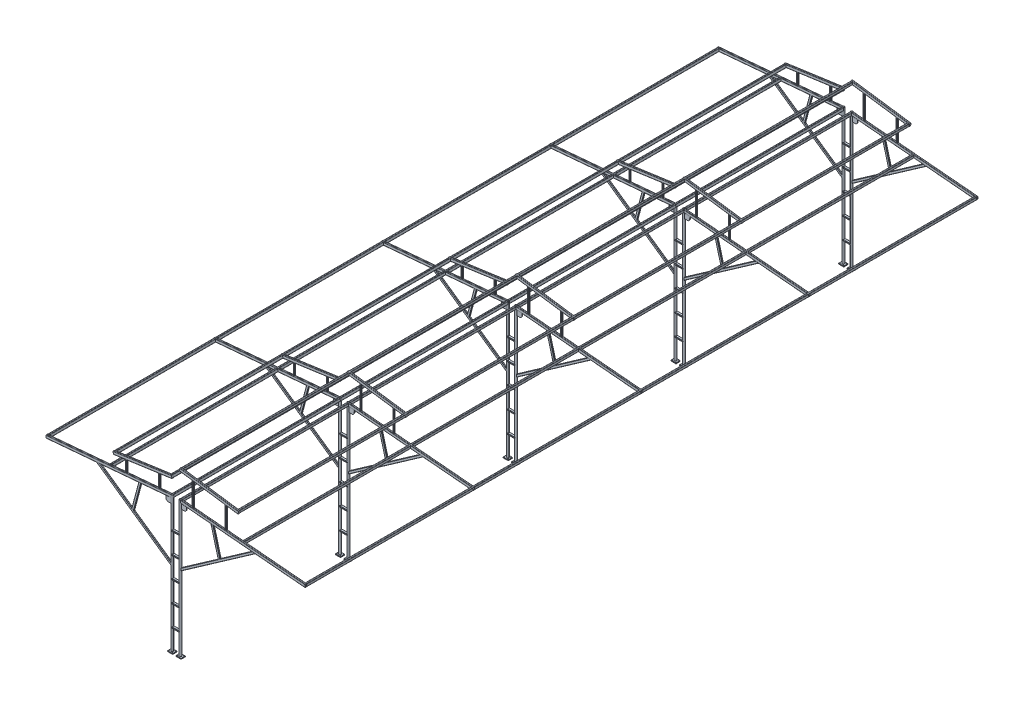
SolidWorks part; units mm, degrees
ref_plane "Default Plane" through (60, 0, 16050) normal (0, -1, 0) x (-1, 0, 0)
sketch3d "Bounding-Box_Cut-List-Item1"
  line L0 (0, 100, 0) -> (120, 100, 0) construction
  line L1 (120, 100, 0) -> (120, 0, 0) construction
  line L2 (120, 0, 0) -> (0, 0, 0) construction
  line L3 (0, 0, 0) -> (0, 100, 0) construction
  line L4 (0, 100, 20) -> (120, 100, 20) construction
  line L5 (120, 100, 20) -> (120, 0, 20) construction
  line L6 (120, 0, 20) -> (0, 0, 20) construction
  line L7 (0, 0, 20) -> (0, 100, 20) construction
  line L8 (0, 100, 0) -> (0, 100, 20) construction
  line L9 (120, 100, 0) -> (120, 100, 20) construction
  line L10 (120, 0, 0) -> (120, 0, 20) construction
  line L11 (0, 0, 0) -> (0, 0, 20) construction
ref_plane "Front Plane" through (0, 0, 0) normal (0, 0, 1) x (1, 0, 0)
ref_plane "Top Plane" through (0, 0, 0) normal (0, 1, 0) x (1, 0, 0)
ref_plane "Right Plane" through (0, 0, 0) normal (1, 0, 0) x (0, 0, -1)
other "Configuration Table"
ref_plane "Plane1" through (0, 0, 4000) normal (0, 0, 1) x (1, 0, 0)
ref_plane "Plane2" through (0, 0, 8000) normal (0, 0, 1) x (1, 0, 0)
ref_plane "Plane3" through (0, 0, 12000) normal (0, 0, 1) x (1, 0, 0)
ref_plane "Plane4" through (0, 0, 16000) normal (0, 0, 1) x (1, 0, 0)
sketch "Sketch1" plane through (0, 0, 0) normal (0, 0, 1) x (1, 0, 0)
  line L0 (-200, 0) -> (-200, 3200)
  line L1 (0, 0) -> (0, 3200)
  line L2 (-200, 3200) -> (-3188.5841, 2938.5328)
  line L3 (0, 3200) -> (2988.5841, 2938.5328)
  line L4 (-200, 1782.1468) -> (-2000, 3042.5204)
  line L5 (-950, 3134.3835) -> (-1136.6049, 2437.9646)
  line L6 (0, 1782.1468) -> (1800, 3042.5204)
  line L7 (750, 3134.3835) -> (936.6049, 2437.9646)
  line L8 (-100, 436.796) -> (-100, 4123.4848) construction
  line L9 (-500, 3173.7534) -> (-500, 3557.8377)
  line L10 (-1286.3753, 3104.9545) -> (-1286.3753, 3447.3199)
  line L11 (-1586.3753, 3405.1577) -> (-200, 3600)
  line L12 (0, 3850) -> (1386.3753, 3655.1577)
  line L13 (300, 3807.8377) -> (300, 3173.7534)
  line L14 (1086.3753, 3697.3199) -> (1086.3753, 3104.9545)
  dimension "D1" = 3200
  dimension "D2" = 3200
  dimension "D3" = 200
  dimension "D4" = 85
  dimension "D5" = 3000
  dimension "D6" = 85
  dimension "D7" = 40
  dimension "D8" = 70
  dimension "D9" = 750
  dimension "D10" = 1800
  dimension "D11" = 1800
  dimension "D12" = 750
  dimension "D13" = 70
  dimension "D14" = 1400
  dimension "D15" = 400
  dimension "D16" = 300
  dimension "D17" = 300
  dimension "D18" = 3
  dimension "D19" = 650
  dimension "D20" = 1400
  dimension "D21" = 300
  dimension "D22" = 3
  dimension "D23" = 300
sketch "Sketch3" plane through (0, 0, 4000) normal (0, 0, 1) x (1, 0, 0)
  line L0 (-1286.3753, 3104.9545) -> (-1286.3753, 3447.3199) construction
  line L1 (750, 3134.3835) -> (936.6049, 2437.9646) construction
  line L2 (0, 1782.1468) -> (1800, 3042.5204) construction
  line L3 (-950, 3134.3835) -> (-1136.6049, 2437.9646) construction
  line L4 (-200, 1782.1468) -> (-2000, 3042.5204) construction
  line L5 (0, 0) -> (0, 3200) construction
  line L6 (0, 3200) -> (2988.5841, 2938.5328) construction
  line L7 (-200, 0) -> (-200, 3200) construction
  line L8 (-200, 3200) -> (-3188.5841, 2938.5328) construction
  line L9 (1086.3753, 3697.3199) -> (1086.3753, 3104.9545) construction
  line L10 (300, 3807.8377) -> (300, 3173.7534) construction
  line L11 (-1586.3753, 3405.1577) -> (-200, 3600) construction
  line L12 (-500, 3173.7534) -> (-500, 3557.8377) construction
  line L13 (0, 3850) -> (1386.3753, 3655.1577) construction
  line L14 (-1286.3753, 3104.9545) -> (-1286.3753, 3447.3199)
  line L15 (750, 3134.3835) -> (936.6049, 2437.9646)
  line L16 (0, 1782.1468) -> (1800, 3042.5204)
  line L17 (-950, 3134.3835) -> (-1136.6049, 2437.9646)
  line L18 (-200, 1782.1468) -> (-2000, 3042.5204)
  line L19 (0, 0) -> (0, 3200)
  line L20 (0, 3200) -> (2988.5841, 2938.5328)
  line L21 (-200, 0) -> (-200, 3200)
  line L22 (-200, 3200) -> (-3188.5841, 2938.5328)
  line L23 (1086.3753, 3697.3199) -> (1086.3753, 3104.9545)
  line L24 (300, 3807.8377) -> (300, 3173.7534)
  line L25 (-1586.3753, 3405.1577) -> (-200, 3600)
  line L26 (-500, 3173.7534) -> (-500, 3557.8377)
  line L27 (0, 3850) -> (1386.3753, 3655.1577)
sketch "Sketch4" plane through (0, 0, 8000) normal (0, 0, 1) x (1, 0, 0)
  line L0 (-1286.3753, 3104.9545) -> (-1286.3753, 3447.3199) construction
  line L1 (750, 3134.3835) -> (936.6049, 2437.9646) construction
  line L2 (0, 1782.1468) -> (1800, 3042.5204) construction
  line L3 (-950, 3134.3835) -> (-1136.6049, 2437.9646) construction
  line L4 (-200, 1782.1468) -> (-2000, 3042.5204) construction
  line L5 (0, 0) -> (0, 3200) construction
  line L6 (0, 3200) -> (2988.5841, 2938.5328) construction
  line L7 (-200, 0) -> (-200, 3200) construction
  line L8 (-200, 3200) -> (-3188.5841, 2938.5328) construction
  line L9 (1086.3753, 3697.3199) -> (1086.3753, 3104.9545) construction
  line L10 (300, 3807.8377) -> (300, 3173.7534) construction
  line L11 (-1586.3753, 3405.1577) -> (-200, 3600) construction
  line L12 (-500, 3173.7534) -> (-500, 3557.8377) construction
  line L13 (0, 3850) -> (1386.3753, 3655.1577) construction
  line L14 (-1286.3753, 3104.9545) -> (-1286.3753, 3447.3199)
  line L15 (750, 3134.3835) -> (936.6049, 2437.9646)
  line L16 (0, 1782.1468) -> (1800, 3042.5204)
  line L17 (-950, 3134.3835) -> (-1136.6049, 2437.9646)
  line L18 (-200, 1782.1468) -> (-2000, 3042.5204)
  line L19 (0, 0) -> (0, 3200)
  line L20 (0, 3200) -> (2988.5841, 2938.5328)
  line L21 (-200, 0) -> (-200, 3200)
  line L22 (-200, 3200) -> (-3188.5841, 2938.5328)
  line L23 (1086.3753, 3697.3199) -> (1086.3753, 3104.9545)
  line L24 (300, 3807.8377) -> (300, 3173.7534)
  line L25 (-1586.3753, 3405.1577) -> (-200, 3600)
  line L26 (-500, 3173.7534) -> (-500, 3557.8377)
  line L27 (0, 3850) -> (1386.3753, 3655.1577)
sketch "Sketch5" plane through (0, 0, 12000) normal (0, 0, 1) x (1, 0, 0)
  line L0 (-1286.3753, 3104.9545) -> (-1286.3753, 3447.3199) construction
  line L1 (750, 3134.3835) -> (936.6049, 2437.9646) construction
  line L2 (0, 1782.1468) -> (1800, 3042.5204) construction
  line L3 (-950, 3134.3835) -> (-1136.6049, 2437.9646) construction
  line L4 (-200, 1782.1468) -> (-2000, 3042.5204) construction
  line L5 (0, 0) -> (0, 3200) construction
  line L6 (0, 3200) -> (2988.5841, 2938.5328) construction
  line L7 (-200, 0) -> (-200, 3200) construction
  line L8 (-200, 3200) -> (-3188.5841, 2938.5328) construction
  line L9 (1086.3753, 3697.3199) -> (1086.3753, 3104.9545) construction
  line L10 (300, 3807.8377) -> (300, 3173.7534) construction
  line L11 (-1586.3753, 3405.1577) -> (-200, 3600) construction
  line L12 (-500, 3173.7534) -> (-500, 3557.8377) construction
  line L13 (0, 3850) -> (1386.3753, 3655.1577) construction
  line L14 (-1286.3753, 3104.9545) -> (-1286.3753, 3447.3199)
  line L15 (750, 3134.3835) -> (936.6049, 2437.9646)
  line L16 (0, 1782.1468) -> (1800, 3042.5204)
  line L17 (-950, 3134.3835) -> (-1136.6049, 2437.9646)
  line L18 (-200, 1782.1468) -> (-2000, 3042.5204)
  line L19 (0, 0) -> (0, 3200)
  line L20 (0, 3200) -> (2988.5841, 2938.5328)
  line L21 (-200, 0) -> (-200, 3200)
  line L22 (-200, 3200) -> (-3188.5841, 2938.5328)
  line L23 (1086.3753, 3697.3199) -> (1086.3753, 3104.9545)
  line L24 (300, 3807.8377) -> (300, 3173.7534)
  line L25 (-1586.3753, 3405.1577) -> (-200, 3600)
  line L26 (-500, 3173.7534) -> (-500, 3557.8377)
  line L27 (0, 3850) -> (1386.3753, 3655.1577)
sketch "Sketch6" plane through (0, 0, 16000) normal (0, 0, 1) x (1, 0, 0)
  line L0 (-1286.3753, 3104.9545) -> (-1286.3753, 3447.3199) construction
  line L1 (750, 3134.3835) -> (936.6049, 2437.9646) construction
  line L2 (0, 1782.1468) -> (1800, 3042.5204) construction
  line L3 (-950, 3134.3835) -> (-1136.6049, 2437.9646) construction
  line L4 (-200, 1782.1468) -> (-2000, 3042.5204) construction
  line L5 (0, 0) -> (0, 3200) construction
  line L6 (0, 3200) -> (2988.5841, 2938.5328) construction
  line L7 (-200, 0) -> (-200, 3200) construction
  line L8 (-200, 3200) -> (-3188.5841, 2938.5328) construction
  line L9 (1086.3753, 3697.3199) -> (1086.3753, 3104.9545) construction
  line L10 (300, 3807.8377) -> (300, 3173.7534) construction
  line L11 (-1586.3753, 3405.1577) -> (-200, 3600) construction
  line L12 (-500, 3173.7534) -> (-500, 3557.8377) construction
  line L13 (0, 3850) -> (1386.3753, 3655.1577) construction
  line L14 (-1286.3753, 3104.9545) -> (-1286.3753, 3447.3199)
  line L15 (750, 3134.3835) -> (936.6049, 2437.9646)
  line L16 (0, 1782.1468) -> (1800, 3042.5204)
  line L17 (-950, 3134.3835) -> (-1136.6049, 2437.9646)
  line L18 (-200, 1782.1468) -> (-2000, 3042.5204)
  line L19 (0, 0) -> (0, 3200)
  line L20 (0, 3200) -> (2988.5841, 2938.5328)
  line L21 (-200, 0) -> (-200, 3200)
  line L22 (-200, 3200) -> (-3188.5841, 2938.5328)
  line L23 (1086.3753, 3697.3199) -> (1086.3753, 3104.9545)
  line L24 (300, 3807.8377) -> (300, 3173.7534)
  line L25 (-1586.3753, 3405.1577) -> (-200, 3600)
  line L26 (-500, 3173.7534) -> (-500, 3557.8377)
  line L27 (0, 3850) -> (1386.3753, 3655.1577)
other "Structure System1"
sketch3d "Structure System Grid1"
  line L0 (-200, 0, 16000) -> (-200, 3200, 16000)
  line L1 (-200, 0, 12000) -> (-200, 3200, 12000)
  line L2 (-200, 0, 8000) -> (-200, 3200, 8000)
  line L3 (-200, 0, 4000) -> (-200, 3200, 4000)
  line L4 (-200, 0, 0) -> (-200, 3200, 0)
  line L5 (0, 0, 16000) -> (0, 3200, 16000)
  line L6 (0, 0, 12000) -> (0, 3200, 12000)
  line L7 (0, 0, 8000) -> (0, 3200, 8000)
  line L8 (0, 0, 4000) -> (0, 3200, 4000)
  line L9 (0, 0, 0) -> (0, 3200, 0)
  line L10 (-200, 3200, 16000) -> (-3188.5841, 2938.5328, 16000)
  line L11 (0, 3200, 16000) -> (2988.5841, 2938.5328, 16000)
  line L12 (-200, 3200, 12000) -> (-3188.5841, 2938.5328, 12000)
  line L13 (0, 3200, 12000) -> (2988.5841, 2938.5328, 12000)
  line L14 (-200, 3200, 8000) -> (-3188.5841, 2938.5328, 8000)
  line L15 (0, 3200, 8000) -> (2988.5841, 2938.5328, 8000)
  line L16 (-200, 3200, 4000) -> (-3188.5841, 2938.5328, 4000)
  line L17 (0, 3200, 4000) -> (2988.5841, 2938.5328, 4000)
  line L18 (-200, 3200, 0) -> (-3188.5841, 2938.5328, 0)
  line L19 (0, 3200, 0) -> (2988.5841, 2938.5328, 0)
  line L20 (-1586.3753, 3405.1577, 0) -> (-200, 3600, 0)
  line L21 (0, 3850, 0) -> (1386.3753, 3655.1577, 0)
  line L22 (-1586.3753, 3405.1577, 4000) -> (-200, 3600, 4000)
  line L23 (0, 3850, 4000) -> (1386.3753, 3655.1577, 4000)
  line L24 (-1586.3753, 3405.1577, 8000) -> (-200, 3600, 8000)
  line L25 (0, 3850, 8000) -> (1386.3753, 3655.1577, 8000)
  line L26 (-1586.3753, 3405.1577, 12000) -> (-200, 3600, 12000)
  line L27 (0, 3850, 12000) -> (1386.3753, 3655.1577, 12000)
  line L28 (-1586.3753, 3405.1577, 16000) -> (-200, 3600, 16000)
  line L29 (0, 3850, 16000) -> (1386.3753, 3655.1577, 16000)
  line L30 (-1286.3753, 3104.9545, 0) -> (-1286.3753, 3447.3199, 0)
  line L31 (-500, 3173.7534, 0) -> (-500, 3557.8377, 0)
  line L32 (300, 3807.8377, 0) -> (300, 3173.7534, 0)
  line L33 (1086.3753, 3697.3199, 0) -> (1086.3753, 3104.9545, 0)
  line L34 (-1286.3753, 3104.9545, 4000) -> (-1286.3753, 3447.3199, 4000)
  line L35 (-500, 3173.7534, 4000) -> (-500, 3557.8377, 4000)
  line L36 (300, 3807.8377, 4000) -> (300, 3173.7534, 4000)
  line L37 (1086.3753, 3697.3199, 4000) -> (1086.3753, 3104.9545, 4000)
  line L38 (-1286.3753, 3104.9545, 8000) -> (-1286.3753, 3447.3199, 8000)
  line L39 (-500, 3173.7534, 8000) -> (-500, 3557.8377, 8000)
  line L40 (300, 3807.8377, 8000) -> (300, 3173.7534, 8000)
  line L41 (1086.3753, 3697.3199, 8000) -> (1086.3753, 3104.9545, 8000)
  line L42 (-1286.3753, 3104.9545, 12000) -> (-1286.3753, 3447.3199, 12000)
  line L43 (-500, 3173.7534, 12000) -> (-500, 3557.8377, 12000)
  line L44 (300, 3807.8377, 12000) -> (300, 3173.7534, 12000)
  line L45 (1086.3753, 3697.3199, 12000) -> (1086.3753, 3104.9545, 12000)
  line L46 (-1286.3753, 3104.9545, 16000) -> (-1286.3753, 3447.3199, 16000)
  line L47 (-500, 3173.7534, 16000) -> (-500, 3557.8377, 16000)
  line L48 (300, 3807.8377, 16000) -> (300, 3173.7534, 16000)
  line L49 (1086.3753, 3697.3199, 16000) -> (1086.3753, 3104.9545, 16000)
  line L50 (-200, 1782.1468, 16000) -> (-2000, 3042.5204, 16000)
  line L51 (0, 1782.1468, 16000) -> (1800, 3042.5204, 16000)
  line L52 (-200, 1782.1468, 12000) -> (-2000, 3042.5204, 12000)
  line L53 (0, 1782.1468, 12000) -> (1800, 3042.5204, 12000)
  line L54 (-200, 1782.1468, 8000) -> (-2000, 3042.5204, 8000)
  line L55 (0, 1782.1468, 8000) -> (1800, 3042.5204, 8000)
  line L56 (-200, 1782.1468, 4000) -> (-2000, 3042.5204, 4000)
  line L57 (0, 1782.1468, 4000) -> (1800, 3042.5204, 4000)
  line L58 (-200, 1782.1468, 0) -> (-2000, 3042.5204, 0)
  line L59 (0, 1782.1468, 0) -> (1800, 3042.5204, 0)
  line L60 (-950, 3134.3835, 0) -> (-1136.6049, 2437.9646, 0)
  line L61 (750, 3134.3835, 0) -> (936.6049, 2437.9646, 0)
  line L62 (-950, 3134.3835, 4000) -> (-1136.6049, 2437.9646, 4000)
  line L63 (750, 3134.3835, 4000) -> (936.6049, 2437.9646, 4000)
  line L64 (-950, 3134.3835, 8000) -> (-1136.6049, 2437.9646, 8000)
  line L65 (750, 3134.3835, 8000) -> (936.6049, 2437.9646, 8000)
  line L66 (-950, 3134.3835, 12000) -> (-1136.6049, 2437.9646, 12000)
  line L67 (750, 3134.3835, 12000) -> (936.6049, 2437.9646, 12000)
  line L68 (-950, 3134.3835, 16000) -> (-1136.6049, 2437.9646, 16000)
  line L69 (750, 3134.3835, 16000) -> (936.6049, 2437.9646, 16000)
  line L70 (-200, 3200, 16000) -> (-200, 3200, 12000)
  line L71 (-1684.3301, 3070.1379, 16000) -> (-1684.3301, 3070.1379, 12000)
  line L72 (-3168.6602, 2940.2759, 16000) -> (-3168.6602, 2940.2759, 12000)
  line L73 (-200, 3200, 12000) -> (-200, 3200, 8000)
  line L74 (-1684.3301, 3070.1379, 12000) -> (-1684.3301, 3070.1379, 8000)
  line L75 (-200, 500, 16000) -> (0, 500, 16000)
  line L76 (-200, 1000, 16000) -> (0, 1000, 16000)
  line L77 (-200, 1500, 16000) -> (0, 1500, 16000)
  line L78 (-200, 2000, 16000) -> (0, 2000, 16000)
  line L79 (-200, 2500, 16000) -> (0, 2500, 16000)
  line L80 (-200, 500, 12000) -> (0, 500, 12000)
  line L81 (-200, 1000, 12000) -> (0, 1000, 12000)
  line L82 (-200, 1500, 12000) -> (0, 1500, 12000)
  line L83 (-200, 2000, 12000) -> (0, 2000, 12000)
  line L84 (-200, 2500, 12000) -> (0, 2500, 12000)
  line L85 (-200, 500, 8000) -> (0, 500, 8000)
  line L86 (-200, 1000, 8000) -> (0, 1000, 8000)
  line L87 (-200, 1500, 8000) -> (0, 1500, 8000)
  line L88 (-200, 2000, 8000) -> (0, 2000, 8000)
  line L89 (-200, 2500, 8000) -> (0, 2500, 8000)
  line L90 (-200, 500, 4000) -> (0, 500, 4000)
  line L91 (-200, 1000, 4000) -> (0, 1000, 4000)
  line L92 (-200, 1500, 4000) -> (0, 1500, 4000)
  line L93 (-200, 2000, 4000) -> (0, 2000, 4000)
  line L94 (-200, 2500, 4000) -> (0, 2500, 4000)
  line L95 (-200, 500, 0) -> (0, 500, 0)
  line L96 (-200, 1000, 0) -> (0, 1000, 0)
  line L97 (-200, 1500, 0) -> (0, 1500, 0)
  line L98 (-200, 2000, 0) -> (0, 2000, 0)
  line L99 (-200, 2500, 0) -> (0, 2500, 0)
  line L100 (-3168.6602, 2940.2759, 12000) -> (-3168.6602, 2940.2759, 8000)
  line L101 (-200, 3200, 8000) -> (-200, 3200, 4000)
  line L102 (-1684.3301, 3070.1379, 8000) -> (-1684.3301, 3070.1379, 4000)
  line L103 (-3168.6602, 2940.2759, 8000) -> (-3168.6602, 2940.2759, 4000)
  line L104 (-200, 3200, 4000) -> (-200, 3200, 0)
  line L105 (-1684.3301, 3070.1379, 4000) -> (-1684.3301, 3070.1379, 0)
  line L106 (-3168.6602, 2940.2759, 4000) -> (-3168.6602, 2940.2759, 0)
  line L107 (0, 3200, 16000) -> (0, 3200, 12000)
  line L108 (1484.3301, 3070.1379, 16000) -> (1484.3301, 3070.1379, 12000)
  line L109 (2968.6602, 2940.2759, 16000) -> (2968.6602, 2940.2759, 12000)
  line L110 (0, 3200, 12000) -> (0, 3200, 8000)
  line L111 (1484.3301, 3070.1379, 12000) -> (1484.3301, 3070.1379, 8000)
  line L112 (2968.6602, 2940.2759, 12000) -> (2968.6602, 2940.2759, 8000)
  line L113 (0, 3200, 8000) -> (0, 3200, 4000)
  line L114 (1484.3301, 3070.1379, 8000) -> (1484.3301, 3070.1379, 4000)
  line L115 (2968.6602, 2940.2759, 8000) -> (2968.6602, 2940.2759, 4000)
  line L116 (0, 3200, 4000) -> (0, 3200, 0)
  line L117 (1484.3301, 3070.1379, 4000) -> (1484.3301, 3070.1379, 0)
  line L118 (2968.6602, 2940.2759, 4000) -> (2968.6602, 2940.2759, 0)
  line L119 (-1566.5699, 3407.9411, 16000) -> (-1566.5699, 3407.9411, 12000)
  line L120 (-219.8054, 3597.2165, 16000) -> (-219.8054, 3597.2165, 12000)
  line L121 (-1566.5699, 3407.9411, 12000) -> (-1566.5699, 3407.9411, 8000)
  line L122 (-219.8054, 3597.2165, 12000) -> (-219.8054, 3597.2165, 8000)
  line L123 (-1566.5699, 3407.9411, 8000) -> (-1566.5699, 3407.9411, 4000)
  line L124 (-219.8054, 3597.2165, 8000) -> (-219.8054, 3597.2165, 4000)
  line L125 (-1566.5699, 3407.9411, 4000) -> (-1566.5699, 3407.9411, 0)
  line L126 (-219.8054, 3597.2165, 4000) -> (-219.8054, 3597.2165, 0)
  line L127 (19.8054, 3847.2165, 16000) -> (19.8054, 3847.2165, 12000)
  line L128 (1366.5699, 3657.9411, 16000) -> (1366.5699, 3657.9411, 12000)
  line L129 (19.8054, 3847.2165, 12000) -> (19.8054, 3847.2165, 8000)
  line L130 (1366.5699, 3657.9411, 12000) -> (1366.5699, 3657.9411, 8000)
  line L131 (19.8054, 3847.2165, 8000) -> (19.8054, 3847.2165, 4000)
  line L132 (1366.5699, 3657.9411, 8000) -> (1366.5699, 3657.9411, 4000)
  line L133 (19.8054, 3847.2165, 4000) -> (19.8054, 3847.2165, 0)
  line L134 (1366.5699, 3657.9411, 4000) -> (1366.5699, 3657.9411, 0)
other "<ISO><Pipe><50>(1)"
ref_plane "Plane5" through (-200, 0, 16000) normal (0, -1, 0) x (1, 0, 0)
sketch "Sketch11" plane through (-200, 0, 16000) normal (0, -1, 0) x (1, 0, 0)
  line L0 (0, 25) -> (0, -25) construction
  line L1 (-25, 0) -> (25, 0) construction
  circle A0 centre (0, 0) radius 25
  circle A1 centre (0, 0) radius 21
  point P7 (0, 0)
  dimension "D2" = 50
  dimension "D1" = 4
other "Member1"
other "Member2"
other "Member3"
other "Member4"
other "Member5"
other "Member6"
other "Member7"
other "Member8"
other "Member9"
other "Member10"
other "<ISO><rectangular tube><70 x 40 x 5>(1)"
ref_plane "Plane6" through (-200, 3200, 0) normal (0.9962, 0.0872, 0) x (0, 0, 1)
sketch "Sketch12" plane through (-200, 3200, 0) normal (0.9962, 0.0872, 0) x (0, 0, 1)
  line L0 (-10, -30) -> (10, -30)
  line L1 (-15, -25) -> (-15, 25)
  line L2 (10, 30) -> (-10, 30)
  line L3 (15, 25) -> (15, -25)
  line L4 (-10, -35) -> (10, -35)
  line L5 (-20, -25) -> (-20, 25)
  line L6 (10, 35) -> (-10, 35)
  line L7 (20, 25) -> (20, -25)
  arc A0 (20, 25) -> (10, 35) centre (10, 25) ccw
  arc A1 (10, -35) -> (20, -25) centre (10, -25) ccw
  arc A2 (-20, -25) -> (-10, -35) centre (-10, -25) ccw
  arc A3 (-10, 35) -> (-20, 25) centre (-10, 25) ccw
  arc A4 (-10, 30) -> (-15, 25) centre (-10, 25) ccw
  arc A5 (15, 25) -> (10, 30) centre (10, 25) ccw
  arc A6 (10, -30) -> (15, -25) centre (10, -25) ccw
  arc A7 (-15, -25) -> (-10, -30) centre (-10, -25) ccw
  point P0 (0, 35)
  point P1 (20, 0)
  point P2 (0, -35)
  point P3 (-20, 0)
  point P4 (-20, 35)
  point P5 (20, 35)
  point P6 (20, -35)
  point P7 (-20, -35)
  point P8 (0, 0)
  point P33 (0, 0)
  dimension "D1" = 10
  dimension "Thickness" = 5
  dimension "V_leg" = 70
  dimension "H_leg" = 40
other "Member11"
other "Member12"
other "Member13"
other "Member14"
other "Member15"
other "Member16"
other "Member17"
other "Member18"
other "Member19"
other "Member20"
other "Member21"
other "Member22"
other "Member23"
other "Member24"
other "Member25"
other "Member26"
other "Member27"
other "Member28"
other "Member29"
other "Member30"
other "Member101"
other "Member102"
other "Member103"
other "Member104"
other "Member105"
other "Member106"
other "Member107"
other "Member108"
other "Member109"
other "Member110"
other "Member111"
other "Member112"
other "Member113"
other "Member114"
other "Member115"
other "Member116"
other "Member117"
other "Member118"
other "Member119"
other "Member120"
other "Member121"
other "Member122"
other "Member123"
other "Member124"
other "Member125"
other "Member126"
other "Member127"
other "Member128"
other "Member129"
other "Member130"
other "Member131"
other "Member132"
other "Member133"
other "Member134"
other "Member135"
other "Member136"
other "Member137"
other "Member138"
other "Member139"
other "Member140"
other "<ISO><square tube><30 X 30 X 2.6>(1)"
ref_plane "Plane7" through (-1286.3753, 3104.9545, 0) normal (0, -1, 0) x (1, 0, 0)
sketch "Sketch13" plane through (-1286.3753, 3104.9545, 0) normal (0, -1, 0) x (1, 0, 0)
  line L0 (-9.8, -12.4) -> (9.8, -12.4)
  line L1 (-12.4, -9.8) -> (-12.4, 9.8)
  line L2 (9.8, 12.4) -> (-9.8, 12.4)
  line L3 (12.4, 9.8) -> (12.4, -9.8)
  line L4 (-9.8, -15) -> (9.8, -15)
  line L5 (-15, -9.8) -> (-15, 9.8)
  line L6 (9.8, 15) -> (-9.8, 15)
  line L7 (15, 9.8) -> (15, -9.8)
  line L8 (-15, 0) -> (-12.4, 0) construction
  line L9 (-12.4, 0) -> (12.4, 0) construction
  line L10 (12.4, 0) -> (15, 0) construction
  line L12 (0, 15) -> (0, 12.4) construction
  line L13 (0, 12.4) -> (0, -12.4) construction
  line L14 (0, -12.4) -> (0, -15) construction
  arc A0 (15, 9.8) -> (9.8, 15) centre (9.8, 9.8) ccw
  arc A1 (9.8, -15) -> (15, -9.8) centre (9.8, -9.8) ccw
  arc A2 (-15, -9.8) -> (-9.8, -15) centre (-9.8, -9.8) ccw
  arc A3 (-9.8, 15) -> (-15, 9.8) centre (-9.8, 9.8) ccw
  arc A4 (-9.8, 12.4) -> (-12.4, 9.8) centre (-9.8, 9.8) ccw
  arc A5 (12.4, 9.8) -> (9.8, 12.4) centre (9.8, 9.8) ccw
  arc A6 (9.8, -12.4) -> (12.4, -9.8) centre (9.8, -9.8) ccw
  arc A7 (-12.4, -9.8) -> (-9.8, -12.4) centre (-9.8, -9.8) ccw
  point P2 (-15, 15)
  point P33 (-15, -15)
  point P34 (15, -15)
  point P36 (15, 15)
  point P37 (0, 0)
  dimension "D1" = 5.2
  dimension "Thickness" = 2.6
  dimension "V_leg" = 30
  dimension "H_leg" = 30
other "Member31"
other "Member32"
other "Member33"
other "Member34"
other "Member35"
other "Member36"
other "Member37"
other "Member38"
other "Member39"
other "Member40"
other "Member41"
other "Member42"
other "Member43"
other "Member44"
other "Member45"
other "Member46"
other "Member47"
other "Member48"
other "Member49"
other "Member50"
other "<ISO><rectangular tube><50 x 30 x 2.6>(1)"
ref_plane "Plane8" through (-200, 1782.1468, 16000) normal (-0.8192, 0.5736, 0) x (0, 0, 1)
sketch "Sketch14" plane through (-200, 1782.1468, 16000) normal (-0.8192, 0.5736, 0) x (0, 0, 1)
  line L0 (-9.8, -22.4) -> (9.8, -22.4)
  line L1 (-12.4, -19.8) -> (-12.4, 19.8)
  line L2 (9.8, 22.4) -> (-9.8, 22.4)
  line L3 (12.4, 19.8) -> (12.4, -19.8)
  line L4 (-9.8, -25) -> (9.8, -25)
  line L5 (-15, -19.8) -> (-15, 19.8)
  line L6 (9.8, 25) -> (-9.8, 25)
  line L7 (15, 19.8) -> (15, -19.8)
  arc A0 (15, 19.8) -> (9.8, 25) centre (9.8, 19.8) ccw
  arc A1 (9.8, -25) -> (15, -19.8) centre (9.8, -19.8) ccw
  arc A2 (-15, -19.8) -> (-9.8, -25) centre (-9.8, -19.8) ccw
  arc A3 (-9.8, 25) -> (-15, 19.8) centre (-9.8, 19.8) ccw
  arc A4 (-9.8, 22.4) -> (-12.4, 19.8) centre (-9.8, 19.8) ccw
  arc A5 (12.4, 19.8) -> (9.8, 22.4) centre (9.8, 19.8) ccw
  arc A6 (9.8, -22.4) -> (12.4, -19.8) centre (9.8, -19.8) ccw
  arc A7 (-12.4, -19.8) -> (-9.8, -22.4) centre (-9.8, -19.8) ccw
  point P0 (0, 25)
  point P1 (15, 0)
  point P2 (0, -25)
  point P3 (-15, 0)
  point P4 (-15, 25)
  point P5 (15, 25)
  point P6 (15, -25)
  point P7 (-15, -25)
  point P8 (0, 0)
  point P33 (0, 0)
  dimension "D1" = 5.2
  dimension "Thickness" = 2.6
  dimension "V_leg" = 50
  dimension "H_leg" = 30
other "Member51"
other "Member52"
other "Member53"
other "Member54"
other "Member55"
other "Member56"
other "Member57"
other "Member58"
other "Member59"
other "Member60"
other "Member61"
other "Member62"
other "Member63"
other "Member64"
other "Member65"
other "Member66"
other "Member67"
other "Member68"
other "Member69"
other "Member70"
other "Member76"
other "Member77"
other "Member78"
other "Member79"
other "Member80"
other "Member81"
other "Member82"
other "Member83"
other "Member84"
other "Member85"
other "Member86"
other "Member87"
other "Member88"
other "Member89"
other "Member90"
other "Member91"
other "Member92"
other "Member93"
other "Member94"
other "Member95"
other "Member96"
other "Member97"
other "Member98"
other "Member99"
other "Member100"
other "Corner Management1"
other "Simple Corner Group1"
other "Corner1"
other "Corner2"
other "Corner3"
other "Corner4"
other "Corner5"
other "Corner6"
other "Corner7"
other "Corner8"
other "Corner9"
other "Corner10"
other "Corner11"
other "Corner12"
other "Corner13"
other "Corner14"
other "Corner15"
other "Corner16"
other "Corner17"
other "Corner18"
other "Corner19"
other "Corner20"
other "Corner21"
other "Corner22"
other "Corner23"
other "Corner24"
other "Corner25"
other "Corner26"
other "Corner27"
other "Corner28"
other "Corner29"
other "Corner30"
other "Corner31"
other "Corner32"
other "Corner33"
other "Corner34"
other "Corner35"
other "Corner36"
other "Corner37"
other "Corner38"
other "Corner39"
other "Corner40"
other "Corner41"
other "Corner42"
other "Corner43"
other "Corner44"
other "Corner45"
other "Corner46"
other "Corner47"
other "Corner48"
other "Corner49"
other "Corner50"
other "Corner51"
other "Corner52"
other "Corner53"
other "Corner54"
other "Corner55"
other "Corner56"
other "Corner57"
other "Corner58"
other "Corner59"
other "Corner60"
other "Corner61"
other "Corner62"
other "Corner63"
other "Corner64"
other "Corner65"
other "Corner66"
other "Corner67"
other "Corner68"
other "Corner69"
other "Corner70"
other "Corner71"
other "Corner72"
other "Corner73"
other "Corner74"
other "Corner75"
other "Corner76"
other "Corner77"
other "Corner78"
other "Corner79"
other "Corner80"
other "Corner81"
other "Corner82"
other "Corner83"
other "Corner84"
other "Corner85"
other "Corner86"
other "Corner87"
other "Corner88"
other "Corner89"
other "Corner90"
other "Corner101"
other "Corner102"
other "Corner103"
other "Corner104"
other "Corner105"
other "Corner106"
other "Corner107"
other "Corner108"
other "Corner109"
other "Corner110"
other "Corner111"
other "Corner112"
other "Corner113"
other "Corner114"
other "Corner115"
other "Corner116"
other "Corner117"
other "Corner118"
other "Corner119"
other "Corner120"
other "Corner121"
other "Corner122"
other "Corner123"
other "Corner124"
other "Corner125"
other "Corner126"
other "Corner127"
other "Corner128"
other "Corner129"
other "Corner130"
other "Corner131"
other "Corner132"
other "Corner133"
other "Corner134"
other "Corner135"
other "Corner136"
other "Corner137"
other "Corner138"
other "Corner139"
other "Corner140"
other "Corner141"
other "Corner142"
other "Corner167"
other "Corner168"
other "Corner169"
other "Corner170"
other "Corner171"
other "Corner172"
other "Corner173"
other "Corner174"
other "Corner175"
other "Corner176"
other "Corner177"
other "Corner178"
other "Corner179"
other "Corner180"
other "Complex Corner Group1"
other "Corner91"
other "Corner92"
other "Corner93"
other "Corner94"
other "Corner95"
other "Corner96"
other "Corner97"
other "Corner98"
other "Corner99"
other "Corner100"
other "Corner143"
other "Corner144"
other "Corner145"
other "Corner146"
other "Corner147"
other "Corner148"
other "Corner149"
other "Corner150"
other "Corner151"
other "Corner152"
other "Corner153"
other "Corner154"
other "Corner155"
other "Corner156"
other "Corner157"
other "Corner158"
other "Corner159"
other "Corner160"
other "Corner161"
other "Corner162"
other "Corner163"
other "Corner164"
other "Corner165"
other "Corner166"
other "End cap1" parameters "D1"=5, "D2"=3, "D3"=3
sketch "Sketch15" plane through (-530.6019, 74.5712, 0) normal (-0.9903, 0.1392, 0) x (0, 0, 1)
  line L0 (15985.5, 3845.0321) -> (15982.5, 3842.0321)
  line L1 (15980, 3812.5321) -> (16020, 3812.5321) construction
  line L2 (16014.5, 3845.0321) -> (15985.5, 3845.0321)
  line L3 (16017.5, 3842.0321) -> (16017.5, 3783.0321)
  line L4 (16014.5, 3780.0321) -> (15985.5, 3780.0321)
  line L5 (15982.5, 3842.0321) -> (15982.5, 3783.0321)
  line L6 (15980, 3787.5321) -> (15980, 3837.5321) construction
  line L7 (16000, 3847.5321) -> (16000, 3777.5321) construction
  line L8 (15990, 3847.5321) -> (16010, 3847.5321) construction
  line L9 (15990.2, 3777.5321) -> (16009.8, 3777.5321) construction
  line L10 (16017.5, 3842.0321) -> (16014.5, 3845.0321)
  line L11 (16017.5, 3783.0321) -> (16014.5, 3780.0321)
  line L12 (15985.5, 3780.0321) -> (15982.5, 3783.0321)
  line L13 (16020, 3837.5321) -> (16020, 3787.5321) construction
  point P0 (16017.5, 3845.0321)
  point P3 (15982.5, 3780.0321)
  point P9 (16017.5, 3780.0321)
  point P10 (15982.5, 3845.0321)
  dimension "D1" = 35
  dimension "D2" = 65
other "End cap2" parameters "D1"=5, "D2"=3, "D3"=3
other "Gusset1" parameters "D1"=10, "D2"=10, "D3"=0, "D4"=0, "D10"=5, "D11"=125, "D12"=125, "D13"=85, "D14"=45, "D15"=82.044, "D16"=22.5, "D17"=22.5, "D18"=47.5
sketch "Sketch16" plane through (25, 3162.6791, 16000) normal (0, 0, 1) x (1, 0, 0)
  line L0 (0, 0) -> (0, -125)
  line L1 (0, 0) -> (124.5243, -10.8945)
  line L2 (85, -125) -> (117.3737, -92.6263)
  line L3 (0, -125) -> (85, -125)
  line L4 (124.5243, -10.8945) -> (117.3737, -92.6263)
other "Gusset2" parameters "D1"=15, "D2"=15, "D3"=0, "D4"=0, "D10"=5, "D11"=125, "D12"=125, "D13"=85, "D14"=45, "D15"=82.044
sketch "Sketch17" plane through (-225, 3162.6791, 16000) normal (0, 0, -1) x (-1, 0, 0)
  line L0 (0, 0) -> (0, -125)
  line L1 (0, 0) -> (124.5243, -10.8945)
  line L2 (85, -125) -> (117.3737, -92.6263)
  line L3 (0, -125) -> (85, -125)
  line L4 (124.5243, -10.8945) -> (117.3737, -92.6263)
other "Gusset3" parameters "D1"=15, "D2"=15, "D3"=0, "D4"=0, "D10"=5, "D11"=125, "D12"=125, "D13"=85, "D14"=45, "D15"=82.044
sketch "Sketch18" plane through (-225, 3162.6791, 12000) normal (0, 0, -1) x (-1, 0, 0)
  line L0 (0, 0) -> (0, -125)
  line L1 (0, 0) -> (124.5243, -10.8945)
  line L2 (85, -125) -> (117.3737, -92.6263)
  line L3 (0, -125) -> (85, -125)
  line L4 (124.5243, -10.8945) -> (117.3737, -92.6263)
other "Gusset4" parameters "D1"=15, "D2"=15, "D3"=0, "D4"=0, "D10"=5, "D11"=125, "D12"=125, "D13"=85, "D14"=45, "D15"=82.044
sketch "Sketch19" plane through (25, 3162.6791, 12000) normal (0, 0, 1) x (1, 0, 0)
  line L0 (0, 0) -> (0, -125)
  line L1 (0, 0) -> (124.5243, -10.8945)
  line L2 (85, -125) -> (117.3737, -92.6263)
  line L3 (0, -125) -> (85, -125)
  line L4 (124.5243, -10.8945) -> (117.3737, -92.6263)
other "Gusset5" parameters "D1"=15, "D2"=15, "D3"=0, "D4"=0, "D10"=5, "D11"=125, "D12"=125, "D13"=85, "D14"=45, "D15"=82.044
sketch "Sketch20" plane through (25, 3162.6791, 8000) normal (0, 0, 1) x (1, 0, 0)
  line L0 (0, 0) -> (0, -125)
  line L1 (0, 0) -> (124.5243, -10.8945)
  line L2 (85, -125) -> (117.3737, -92.6263)
  line L3 (0, -125) -> (85, -125)
  line L4 (124.5243, -10.8945) -> (117.3737, -92.6263)
other "Gusset6" parameters "D1"=15, "D2"=15, "D3"=0, "D4"=0, "D10"=5, "D11"=125, "D12"=125, "D13"=85, "D14"=45, "D15"=82.044
sketch "Sketch21" plane through (-225, 3162.6791, 8000) normal (0, 0, -1) x (-1, 0, 0)
  line L0 (0, 0) -> (0, -125)
  line L1 (0, 0) -> (124.5243, -10.8945)
  line L2 (85, -125) -> (117.3737, -92.6263)
  line L3 (0, -125) -> (85, -125)
  line L4 (124.5243, -10.8945) -> (117.3737, -92.6263)
other "Gusset7" parameters "D1"=15, "D2"=15, "D3"=0, "D4"=0, "D10"=5, "D11"=125, "D12"=125, "D13"=85, "D14"=45, "D15"=82.044
sketch "Sketch22" plane through (25, 3162.6791, 4000) normal (0, 0, 1) x (1, 0, 0)
  line L0 (0, 0) -> (0, -125)
  line L1 (0, 0) -> (124.5243, -10.8945)
  line L2 (85, -125) -> (117.3737, -92.6263)
  line L3 (0, -125) -> (85, -125)
  line L4 (124.5243, -10.8945) -> (117.3737, -92.6263)
other "Gusset8" parameters "D1"=15, "D2"=15, "D3"=0, "D4"=0, "D10"=5, "D11"=125, "D12"=125, "D13"=85, "D14"=45, "D15"=82.044
sketch "Sketch23" plane through (-225, 3162.6791, 4000) normal (0, 0, -1) x (-1, 0, 0)
  line L0 (0, 0) -> (0, -125)
  line L1 (0, 0) -> (124.5243, -10.8945)
  line L2 (85, -125) -> (117.3737, -92.6263)
  line L3 (0, -125) -> (85, -125)
  line L4 (124.5243, -10.8945) -> (117.3737, -92.6263)
other "Gusset9" parameters "D1"=15, "D2"=15, "D3"=0, "D4"=0, "D10"=5, "D11"=125, "D12"=125, "D13"=85, "D14"=45, "D15"=82.044
sketch "Sketch24" plane through (25, 3162.6791, 0) normal (0, 0, 1) x (1, 0, 0)
  line L0 (0, 0) -> (0, -125)
  line L1 (0, 0) -> (124.5243, -10.8945)
  line L2 (85, -125) -> (117.3737, -92.6263)
  line L3 (0, -125) -> (85, -125)
  line L4 (124.5243, -10.8945) -> (117.3737, -92.6263)
other "Gusset10" parameters "D1"=15, "D2"=15, "D3"=0, "D4"=0, "D10"=5, "D11"=125, "D12"=125, "D13"=85, "D14"=45, "D15"=82.044
sketch "Sketch25" plane through (-225, 3162.6791, 0) normal (0, 0, -1) x (-1, 0, 0)
  line L0 (0, 0) -> (0, -125)
  line L1 (0, 0) -> (124.5243, -10.8945)
  line L2 (85, -125) -> (117.3737, -92.6263)
  line L3 (0, -125) -> (85, -125)
  line L4 (124.5243, -10.8945) -> (117.3737, -92.6263)
sketch "Sketch26" plane through (0, 0, 0) normal (0, -1, 0) x (1, 0, 0)
  line L0 (-260, 16050) -> (-260, 15950)
  line L5 (60, 16050) -> (-60, 16050)
  line L6 (60, 16050) -> (60, 15950)
  line L7 (60, 15950) -> (-60, 15950)
  line L8 (-60, 16050) -> (-60, 15950)
  line L9 (60, 16050) -> (-60, 15950) construction
  line L10 (60, 15950) -> (-60, 16050) construction
  line L11 (-140, 16050) -> (-260, 16050)
  line L12 (-140, 16050) -> (-140, 15950)
  line L13 (-140, 15950) -> (-260, 15950)
  line L14 (-260, 12050) -> (-260, 11950)
  line L15 (-140, 12050) -> (-260, 12050)
  line L16 (-140, 12050) -> (-140, 11950)
  line L17 (-140, 11950) -> (-260, 11950)
  line L18 (-260, 8050) -> (-260, 7950)
  line L19 (-140, 8050) -> (-260, 8050)
  line L20 (-140, 8050) -> (-140, 7950)
  line L21 (-140, 7950) -> (-260, 7950)
  line L22 (-260, 4050) -> (-260, 3950)
  line L23 (-140, 4050) -> (-260, 4050)
  line L24 (-140, 4050) -> (-140, 3950)
  line L25 (-140, 3950) -> (-260, 3950)
  line L26 (-260, 50) -> (-260, -50)
  line L27 (-140, 50) -> (-260, 50)
  line L28 (-140, 50) -> (-140, -50)
  line L29 (-140, -50) -> (-260, -50)
  line L30 (-60, 12050) -> (-60, 11950)
  line L31 (60, 12050) -> (-60, 12050)
  line L32 (60, 12050) -> (60, 11950)
  line L33 (60, 11950) -> (-60, 11950)
  line L34 (-60, 8050) -> (-60, 7950)
  line L35 (60, 8050) -> (-60, 8050)
  line L36 (60, 8050) -> (60, 7950)
  line L37 (60, 7950) -> (-60, 7950)
  line L38 (-60, 4050) -> (-60, 3950)
  line L39 (60, 4050) -> (-60, 4050)
  line L40 (60, 4050) -> (60, 3950)
  line L41 (60, 3950) -> (-60, 3950)
  line L42 (-60, 50) -> (-60, -50)
  line L43 (60, 50) -> (-60, 50)
  line L44 (60, 50) -> (60, -50)
  line L45 (60, -50) -> (-60, -50)
  circle A0 centre (40.7945, 16033.9954) radius 7.5
  circle A1 centre (-40.7945, 16033.9954) radius 7.5
  circle A2 centre (-40.7945, 15966.0046) radius 7.5
  circle A3 centre (40.7945, 15966.0046) radius 7.5
  circle A4 centre (-159.2055, 16033.9954) radius 7.5
  circle A5 centre (-159.2055, 15966.0046) radius 7.5
  circle A6 centre (-240.7945, 15966.0046) radius 7.5
  circle A7 centre (-240.7945, 16033.9954) radius 7.5
  circle A8 centre (-159.2055, 12033.9954) radius 7.5
  circle A9 centre (-159.2055, 11966.0046) radius 7.5
  circle A10 centre (-240.7945, 11966.0046) radius 7.5
  circle A11 centre (-240.7945, 12033.9954) radius 7.5
  circle A12 centre (-159.2055, 8033.9954) radius 7.5
  circle A13 centre (-159.2055, 7966.0046) radius 7.5
  circle A14 centre (-240.7945, 7966.0046) radius 7.5
  circle A15 centre (-240.7945, 8033.9954) radius 7.5
  circle A16 centre (-159.2055, 4033.9954) radius 7.5
  circle A17 centre (-159.2055, 3966.0046) radius 7.5
  circle A18 centre (-240.7945, 3966.0046) radius 7.5
  circle A19 centre (-240.7945, 4033.9954) radius 7.5
  circle A20 centre (-159.2055, 33.9954) radius 7.5
  circle A21 centre (-159.2055, -33.9954) radius 7.5
  circle A22 centre (-240.7945, -33.9954) radius 7.5
  circle A23 centre (-240.7945, 33.9954) radius 7.5
  circle A24 centre (40.7945, 12033.9954) radius 7.5
  circle A25 centre (40.7945, 11966.0046) radius 7.5
  circle A26 centre (-40.7945, 11966.0046) radius 7.5
  circle A27 centre (-40.7945, 12033.9954) radius 7.5
  circle A28 centre (40.7945, 8033.9954) radius 7.5
  circle A29 centre (40.7945, 7966.0046) radius 7.5
  circle A30 centre (-40.7945, 7966.0046) radius 7.5
  circle A31 centre (-40.7945, 8033.9954) radius 7.5
  circle A32 centre (40.7945, 4033.9954) radius 7.5
  circle A33 centre (40.7945, 3966.0046) radius 7.5
  circle A34 centre (-40.7945, 3966.0046) radius 7.5
  circle A35 centre (-40.7945, 4033.9954) radius 7.5
  circle A36 centre (40.7945, 33.9954) radius 7.5
  circle A37 centre (40.7945, -33.9954) radius 7.5
  circle A38 centre (-40.7945, -33.9954) radius 7.5
  circle A39 centre (-40.7945, 33.9954) radius 7.5
  point P0 (0, 16000)
  dimension "D3" = 15
  dimension "D1" = 120
  dimension "D2" = 100
  dimension "D4" = 25
  dimension "D5" = 25
  dimension "D6" = 25
  dimension "D7" = 25
  dimension "D8" = 2
  dimension "D9" = 5
extrude "Boss-Extrude1" add sketch "Sketch26" along normal blind 20 separate body
